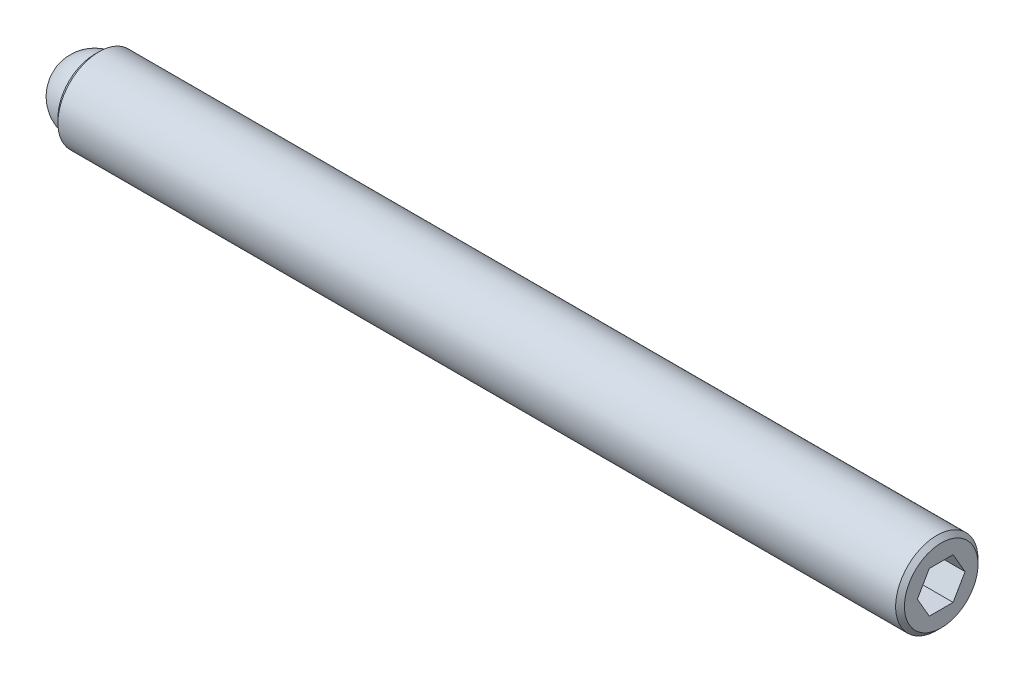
SolidWorks part; units mm, degrees
ref_plane "Front Plane" through (0, 0, 0) normal (0, 0, 1) x (1, 0, 0)
ref_plane "Top Plane" through (0, 0, 0) normal (0, 1, 0) x (1, 0, 0)
ref_plane "Right Plane" through (0, 0, 0) normal (1, 0, 0) x (0, 0, -1)
sketch "Sketch2" plane through (0, 0, 0) normal (1, 0, 0) x (0, 0, -1)
  circle A0 centre (0, 0) radius 2.3749
  dimension "D1" = 4.7498
extrude "Boss-Extrude1" add sketch "Sketch2" along normal blind 48.8156
sketch "Sketch3" plane through (0, 0, 0) normal (-1, 0, 0) x (0, 0, 1)
  circle A0 centre (0, 0) radius 1.9812
  dimension "D1" = 3.9624
chamfer "Chamfer1" distance 0.254 angle 45 1 edges at (0, 0, -2.3749)
chamfer "Chamfer2" distance 0.254 angle 45 1 edges at (48.8156, 0, -2.3749)
sketch "Sketch4" plane through (48.8156, 0, 0) normal (1, 0, 0) x (0, 0, -1)
  line L1 (1.3748, 0) -> (0.6874, 1.1906)
  line L2 (0.6874, 1.1906) -> (-0.6874, 1.1906)
  line L3 (-0.6874, 1.1906) -> (-1.3748, 0)
  line L4 (-1.3748, 0) -> (-0.6874, -1.1906)
  line L5 (-0.6874, -1.1906) -> (0.6874, -1.1906)
  line L6 (0.6874, -1.1906) -> (1.3748, 0)
  circle A0 centre (0, 0) radius 1.1906 construction
  dimension "D1" = 2.3813
extrude "Cut-Extrude2" cut sketch "Sketch4" against normal blind 2.286
extrude "Cut-Extrude3" cut sketch "Sketch3" against normal blind 1.9844
sketch "Sketch5" plane through (0, 0, 0) normal (-1, 0, 0) x (0, 0, 1)
  line L0 (0, 0) -> (0, -1.9844)
  line L1 (0, 0) -> (0, 1.9844)
  arc A0 (0, 1.9844) -> (0, -1.9844) centre (0, 0) ccw
  dimension "D1" = 1.9844
revolve "Revolve1" add sketch "Sketch5" angle 360 about L1
